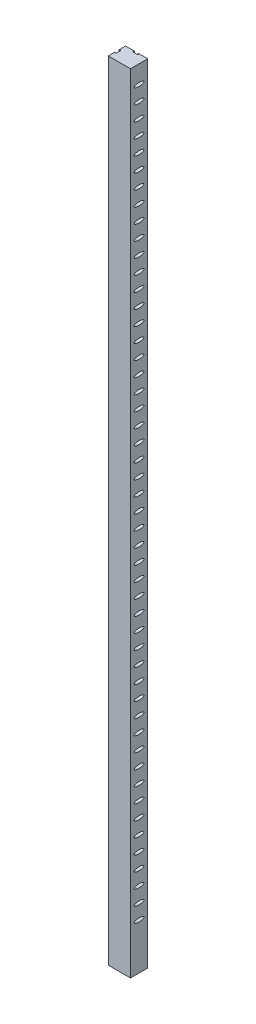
SolidWorks part; units mm, degrees
ref_plane "Plan de face" through (0, 0, 0) normal (0, 0, 1) x (1, 0, 0)
ref_plane "Plan de dessus" through (0, 0, 0) normal (0, 1, 0) x (1, 0, 0)
ref_plane "Plan de droite" through (0, 0, 0) normal (1, 0, 0) x (0, 0, -1)
sketch "Esquisse1" plane through (0, 0, 0) normal (0, 1, 0) x (1, 0, 0)
  line L0 (-22.5, 4) -> (-21.5, 4)
  line L1 (-22.5, -17.5) -> (22.5, -17.5)
  line L2 (-22.5, 4) -> (-22.5, 17.5)
  line L3 (-22.5, 17.5) -> (-4, 17.5)
  line L4 (22.5, -17.5) -> (22.5, 17.5)
  line L5 (-22.5, -17.5) -> (22.5, 17.5) construction
  line L6 (-22.5, 17.5) -> (22.5, -17.5) construction
  line L7 (-21.5, 4) -> (-21.5, 5)
  line L8 (-21.5, 5) -> (-20.5, 5)
  line L9 (-19.5, 4) -> (-19.5, -4)
  line L10 (-20.5, 5) -> (-19.5, 4)
  line L11 (-19.5, -4) -> (-20.5, -5)
  line L12 (-20.5, -5) -> (-21.5, -5)
  line L13 (-21.5, -5) -> (-21.5, -4)
  line L14 (-21.5, -4) -> (-22.5, -4)
  line L15 (-22.5, -4) -> (-22.5, -17.5)
  line L16 (-4, 17.5) -> (-4, 16.5)
  line L17 (-4, 16.5) -> (-5, 16.5)
  line L18 (-5, 16.5) -> (-5, 15.5)
  line L19 (-4, 14.5) -> (4, 14.5)
  line L20 (-5, 15.5) -> (-4, 14.5)
  line L21 (4, 14.5) -> (5, 15.5)
  line L22 (5, 15.5) -> (5, 16.5)
  line L23 (5, 16.5) -> (4, 16.5)
  line L24 (4, 16.5) -> (4, 17.5)
  line L25 (4, 17.5) -> (22.5, 17.5)
  point P0 (0, 0)
  dimension "D1" = 35
  dimension "D2" = 13.5
  dimension "D3" = 8
  dimension "D4" = 1
  dimension "D5" = 1
  dimension "D6" = 1
  dimension "D7" = 1
  dimension "D8" = 1
  dimension "D9" = 1
  dimension "D10" = 1
  dimension "D11" = 1
  dimension "D12" = 1
  dimension "D13" = 1
  dimension "D14" = 8
  dimension "D15" = 18.5
  dimension "D16" = 45
  dimension "D17" = 45
  dimension "D18" = 35
  dimension "D19" = 1
  dimension "D20" = 1
  dimension "D21" = 2
  dimension "D22" = 2
  dimension "D23" = 1.4142
  dimension "D24" = 1.4142
  dimension "D25" = 1.4142
extrude "Extrusion1" add sketch "Esquisse1" along normal blind 1600
sketch "Esquisse2" plane through (22.5, 0, 0) normal (1, 0, 0) x (0, 0, -1)
  line L0 (0, 1600) -> (0, 85) construction
  line L1 (-17.5, 1600) -> (17.5, 1600) construction
  line L2 (-17.5, 0) -> (17.5, 0) construction
  ellipse E0 centre (0, 1563.5) end of major axis (10, 1563.5) minor radius 3.5
  dimension "D1" = 40
  dimension "D2" = 85
  dimension "D3" = 7
  dimension "D4" = 20
extrude "Extrusion2" cut sketch "Esquisse2" against normal blind 10
pattern_linear "Répétition linéaire1" count 50 spacing 30 along (0, -1, 0) of "Extrusion2"
